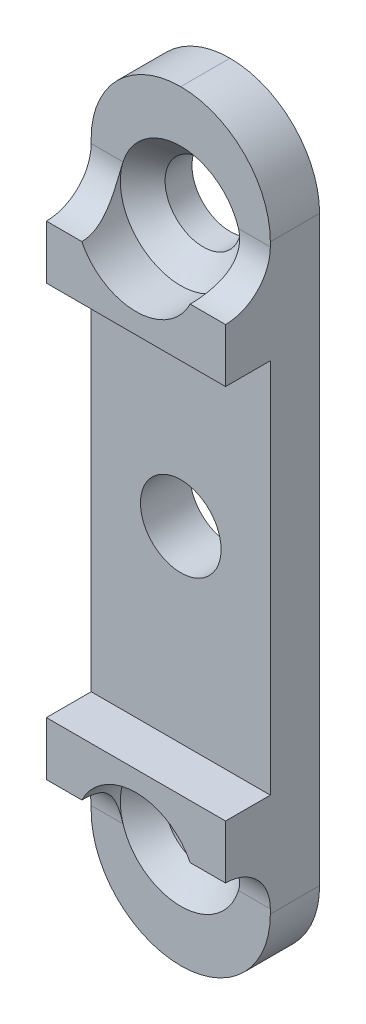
SolidWorks part; units mm, degrees
ref_plane "Front Plane" through (0, 0, 0) normal (0, 0, 1) x (1, 0, 0)
ref_plane "Top Plane" through (0, 0, 0) normal (0, 1, 0) x (1, 0, 0)
ref_plane "Right Plane" through (0, 0, 0) normal (1, 0, 0) x (0, 0, -1)
sketch "Sketch1" plane through (0, 0, 0) normal (0, 0, 1) x (1, 0, 0)
  line L0 (-3.5, 19) -> (4.5, 19)
  line L1 (-3.5, -15) -> (4.5, -15)
  line L2 (-3.5, 19) -> (-3.5, -15)
  line L4 (4.5, 19) -> (4.5, -15)
  circle A1 centre (0.5, 2) radius 1.8
  point P13 (4.5, 2)
  dimension "D1" = 34
  dimension "D2" = 3.6
  dimension "D3" = 8
  dimension "D4" = 4
extrude "Boss-Extrude1" add sketch "Sketch1" along normal blind 2.2
ref_plane "Plane1" through (0, 0, 2.2) normal (0, 0, 1) x (1, 0, 0)
sketch "Sketch3" plane through (0, 0, 0) normal (0, 0, 1) x (1, 0, 0)
  line L0 (4.5, -15) -> (4.5, 19) construction
  line L4 (4.5, 19) -> (-3.5, 19) construction
  line L5 (-3.5, -15) -> (4.5, -15) construction
  line L6 (4.5, -15) -> (4.5, 19) construction
  circle A0 centre (0.5, 14) radius 1.7
  circle A1 centre (0.5, -10) radius 1.7
  dimension "D1" = 3.4
  dimension "D2" = 3.4
  dimension "D3" = 4
  dimension "D4" = 5
  dimension "D5" = 5
  dimension "D6" = 4
extrude "Cut-Extrude1" cut sketch "Sketch3" along normal blind 8
sketch "Sketch2" plane through (0, 0, 2.2) normal (0, 0, 1) x (1, 0, 0)
  line L0 (-3.5, 19) -> (-3.5, -15) construction
  line L1 (-3.5, 12.8) -> (4.5, 12.8)
  line L2 (-3.5, 12.8) -> (-3.5, 10.4)
  line L3 (-3.5, 10.4) -> (4.5, 10.4)
  line L4 (4.5, 12.8) -> (4.5, 10.4)
  line L5 (4.5, -15) -> (4.5, 19) construction
  line L6 (4.5, 19) -> (-3.5, 19) construction
  line L7 (-3.5, -6.4) -> (4.5, -6.4)
  line L8 (-3.5, -6.4) -> (-3.5, -8.8)
  line L9 (-3.5, -8.8) -> (4.5, -8.8)
  line L10 (4.5, -6.4) -> (4.5, -8.8)
  line L12 (-3.5, -15) -> (4.5, -15) construction
  dimension "D1" = 2.4
  dimension "D2" = 2.4
  dimension "D3" = 8.6
  dimension "D4" = 8.6
extrude "Boss-Extrude2" add sketch "Sketch2" along normal blind 2
hole_wizard "CSK for M3 Flat Head Machine Screw1" positions "Sketch4" profile "Sketch5" countersink size "M3" standard "ANSI Metric"
sketch "Sketch4" plane through (0, 0, 2.2) normal (0, 0, 1) x (1, 0, 0)
  point P0 (0.5, 14)
  point P3 (0.5, -10)
sketch "Sketch5" plane through (0.5, 14, 2.2) normal (1, 0, 0) x (0, -1, 0)
  line L0 (0, 0) -> (0, 15.0215)
  line L1 (0, 15.0215) -> (1.7, 14)
  line L2 (1.7, 14) -> (1.7, 1)
  line L3 (1.7, 1) -> (2.7, 0)
  line L5 (2.7, 0) -> (0, 0)
  line L6 (-1.7, 1) -> (-2.7, 0) construction
  line L10 (0, 15.0215) -> (-1.7, 14) construction
  line L11 (0, -6.35) -> (0, 107.95) construction
  dimension "Hole Dia." = 3.4
  dimension "Hole Depth" = 14
  dimension "Near C'Sink Dia." = 5.4
  dimension "Near C'Sink Angle" = 90
  dimension "Drill Angle" = 118
ref_plane "Plane2" through (0, 0, 2.2) normal (0, 0, 1) x (1, 0, 0)
sketch "Sketch6" plane through (0, 0, 2.2) normal (0, 0, 1) x (1, 0, 0)
  circle A0 centre (0.5, 14) radius 2.7
  circle A1 centre (0.5, -10) radius 2.7
  dimension "D1" = 5.4
  dimension "D2" = 5.4
extrude "Cut-Extrude2" cut sketch "Sketch6" along normal blind 8
fillet "Fillet1" radius 2 4 edges at (3.7093, -8.8, 2.2) (-2.7093, -8.8, 2.2) (3.7093, 12.8, 2.2) (-2.7093, 12.8, 2.2)
fillet "Fillet2" radius 4 4 edges at (4.5, -15, 1.1) (-3.5, -15, 1.1) (4.5, 19, 1.1) (-3.5, 19, 1.1)
